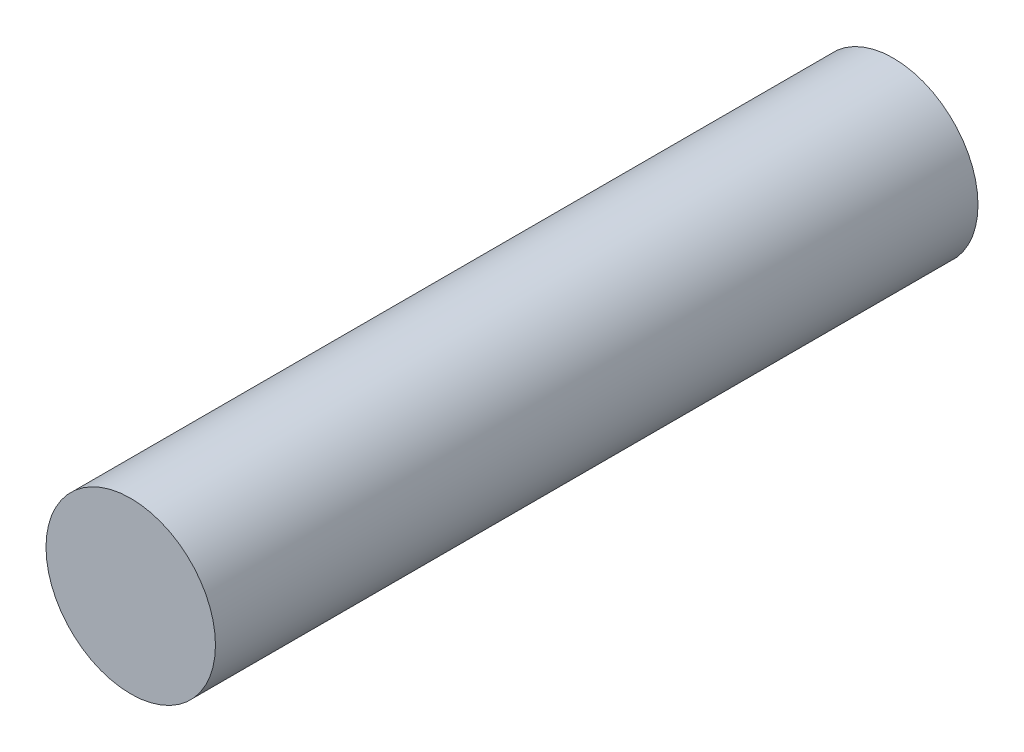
SolidWorks part; units mm, degrees
ref_plane "Face" through (0, 0, 0) normal (0, 0, 1) x (1, 0, 0)
ref_plane "Dessus" through (0, 0, 0) normal (0, 1, 0) x (1, 0, 0)
ref_plane "Droite" through (0, 0, 0) normal (1, 0, 0) x (0, 0, -1)
sketch "Esquisse1" plane through (0, 0, 0) normal (0, 0, 1) x (1, 0, 0)
  circle A0 centre (0, 0) radius 20
  dimension "D1" = 40
extrude "Extrusion1" add sketch "Esquisse1" along normal blind 180
